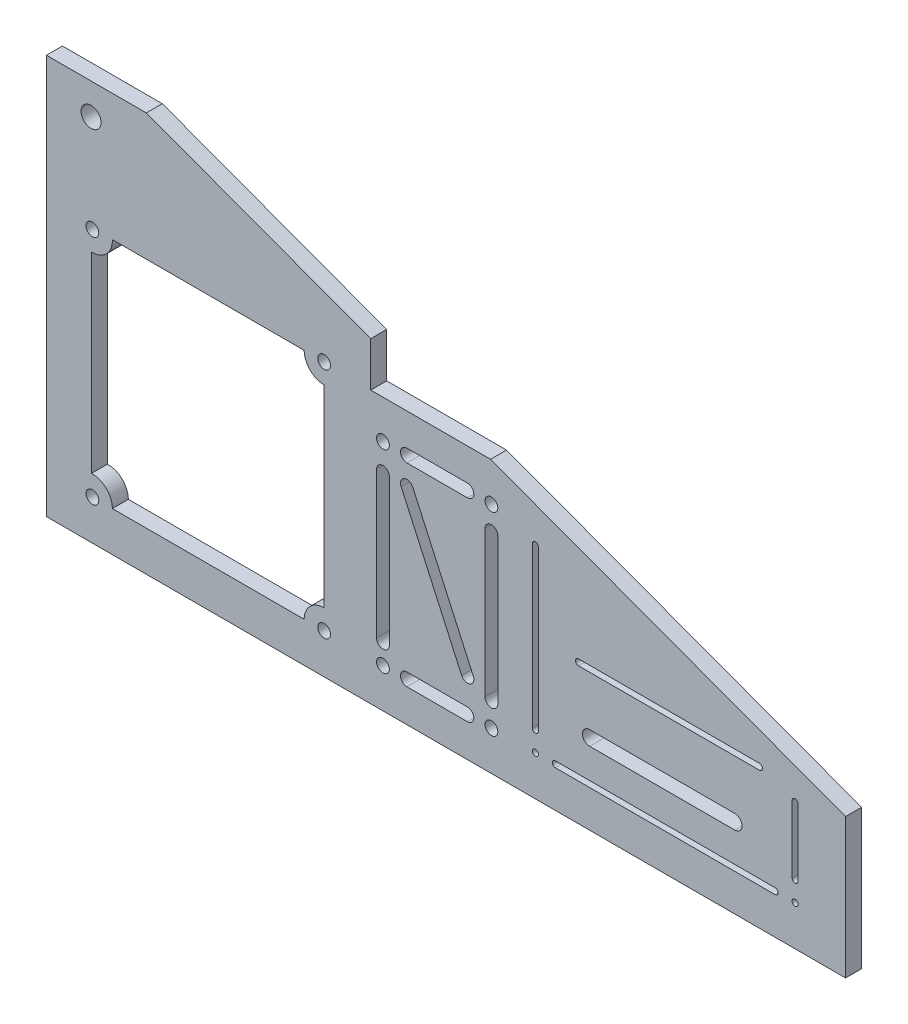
SolidWorks part; units mm, degrees
ref_plane "Front Plane" through (0, 0, 0) normal (0, 0, 1) x (1, 0, 0)
ref_plane "Top Plane" through (0, 0, 0) normal (0, 1, 0) x (1, 0, 0)
ref_plane "Right Plane" through (0, 0, 0) normal (1, 0, 0) x (0, 0, -1)
sketch "Sketch2" plane through (0, 0, 0) normal (0, 0, 1) x (1, 0, 0)
  line L0 (0, 0) -> (0, 73.4827)
  line L1 (0, 73.4827) -> (0, 100)
  line L2 (0, 100) -> (25, 100)
  line L3 (25, 100) -> (81.1538, 79.1429)
  line L4 (200, 35) -> (200, 0)
  line L5 (200, 0) -> (0, 0)
  line L6 (11.2434, 14.9934) -> (11.2434, 63.0066)
  line L7 (16.4916, 68.29) -> (64.5, 68.29)
  line L8 (16.5, 10) -> (64.5, 10)
  line L10 (127.3603, 10) -> (182.3603, 10) construction
  line L11 (127.3603, 10.75) -> (182.3603, 10.75)
  line L12 (127.3603, 9.25) -> (182.3603, 9.25)
  line L13 (122.3603, 15) -> (122.3603, 55) construction
  line L14 (121.6103, 15) -> (121.6103, 55)
  line L15 (123.1103, 15) -> (123.1103, 55)
  line L16 (187.3603, 15) -> (187.3603, 31.7786) construction
  line L17 (186.6103, 15) -> (186.6103, 31.7786)
  line L18 (188.1103, 15) -> (188.1103, 31.7786)
  line L19 (69.5, 15) -> (69.5, 63.29)
  line L22 (90.2154, 9.8312) -> (105.3658, 9.8312) construction
  line L25 (135.9383, 20) -> (172.28, 20) construction
  line L26 (135.9383, 21.8) -> (172.28, 21.8)
  line L27 (135.9383, 18.2) -> (172.28, 18.2)
  line L28 (111.1538, 68) -> (81.1538, 68)
  line L29 (81.1538, 68) -> (81.1538, 79.1429)
  line L30 (111.1538, 68) -> (200, 35)
  line L31 (90.2154, 11.4312) -> (105.3658, 11.4312)
  line L32 (90.2154, 8.2312) -> (105.3658, 8.2312)
  line L33 (84.2154, 15) -> (84.2154, 51.5767) construction
  line L34 (82.6154, 15) -> (82.6154, 51.5767)
  line L35 (85.8154, 15) -> (85.8154, 51.5767)
  line L36 (111.3658, 15.8312) -> (111.3658, 52.3538) construction
  line L37 (109.7658, 15.8312) -> (109.7658, 52.3538)
  line L38 (112.9658, 15.8312) -> (112.9658, 52.3538)
  line L39 (105.3658, 58.3538) -> (90.2154, 58.3538) construction
  line L40 (105.3658, 56.7538) -> (90.2154, 56.7538)
  line L41 (105.3658, 59.9538) -> (90.2154, 59.9538)
  line L42 (90.2154, 51.5767) -> (105.3658, 18.2) construction
  line L43 (91.6723, 52.238) -> (106.8227, 18.8613)
  line L44 (88.7584, 50.9153) -> (103.9089, 17.5387)
  line L45 (133.1492, 35) -> (178.4456, 35) construction
  line L46 (133.1492, 35.75) -> (178.4456, 35.75)
  line L47 (133.1492, 34.25) -> (178.4456, 34.25)
  arc A4 (16.4916, 68.29) -> (11.2434, 63.0066) centre (11.5, 68) cw
  arc A5 (16.5, 10) -> (11.2434, 14.9934) centre (11.5, 10) ccw
  arc A6 (64.5, 10) -> (69.5, 15) centre (69.5, 10) cw
  arc A7 (69.5, 63.29) -> (64.5, 68.29) centre (69.5, 68.29) cw
  circle A8 centre (11.5, 68) radius 1.6
  circle A9 centre (69.5, 68.29) radius 1.6
  circle A10 centre (69.5, 10) radius 1.6
  circle A11 centre (11.5, 10) radius 1.6
  circle A12 centre (122.3603, 10) radius 0.75
  arc A13 (127.3603, 10.75) -> (127.3603, 9.25) centre (127.3603, 10) ccw
  arc A14 (182.3603, 9.25) -> (182.3603, 10.75) centre (182.3603, 10) ccw
  circle A15 centre (187.3603, 10) radius 0.75
  arc A16 (121.6103, 15) -> (123.1103, 15) centre (122.3603, 15) ccw
  arc A17 (123.1103, 55) -> (121.6103, 55) centre (122.3603, 55) ccw
  arc A18 (186.6103, 15) -> (188.1103, 15) centre (187.3603, 15) ccw
  arc A19 (188.1103, 31.7786) -> (186.6103, 31.7786) centre (187.3603, 31.7786) ccw
  arc A25 (135.9383, 21.8) -> (135.9383, 18.2) centre (135.9383, 20) ccw
  arc A26 (172.28, 18.2) -> (172.28, 21.8) centre (172.28, 20) ccw
  circle A27 centre (11.1667, 92.2208) radius 2.5
  circle A28 centre (111.3658, 9.8312) radius 1.6
  circle A29 centre (84.2154, 9.8312) radius 1.6
  arc A30 (90.2154, 11.4312) -> (90.2154, 8.2312) centre (90.2154, 9.8312) ccw
  arc A31 (105.3658, 8.2312) -> (105.3658, 11.4312) centre (105.3658, 9.8312) ccw
  arc A32 (82.6154, 15) -> (85.8154, 15) centre (84.2154, 15) ccw
  arc A33 (85.8154, 51.5767) -> (82.6154, 51.5767) centre (84.2154, 51.5767) ccw
  arc A34 (109.7658, 15.8312) -> (112.9658, 15.8312) centre (111.3658, 15.8312) ccw
  arc A35 (112.9658, 52.3538) -> (109.7658, 52.3538) centre (111.3658, 52.3538) ccw
  arc A36 (105.3658, 56.7538) -> (105.3658, 59.9538) centre (105.3658, 58.3538) ccw
  arc A37 (90.2154, 59.9538) -> (90.2154, 56.7538) centre (90.2154, 58.3538) ccw
  circle A38 centre (84.2154, 58.3538) radius 1.6
  circle A39 centre (111.3658, 58.3538) radius 1.6
  arc A40 (91.6723, 52.238) -> (88.7584, 50.9153) centre (90.2154, 51.5767) ccw
  arc A41 (103.9089, 17.5387) -> (106.8227, 18.8613) centre (105.3658, 18.2) ccw
  arc A42 (133.1492, 35.75) -> (133.1492, 34.25) centre (133.1492, 35) ccw
  arc A43 (178.4456, 34.25) -> (178.4456, 35.75) centre (178.4456, 35) ccw
  point P27 (154.8603, 10)
  point P36 (122.3603, 35)
  point P41 (187.3603, 23.3893)
  point P52 (97.7906, 9.8312)
  point P59 (84.2154, 33.2883)
  point P66 (154.1091, 20)
  point P78 (111.3658, 34.0925)
  point P85 (97.7906, 58.3538)
  point P98 (97.7906, 34.8883)
  point P105 (155.7974, 35)
  dimension "D13" = 58
  dimension "D14" = 5
  dimension "D12" = 5
  dimension "D15" = 3.2
  dimension "D16" = 5
  dimension "D17" = 3.2
  dimension "D18" = 5
  dimension "D19" = 3.2
  dimension "D20" = 1.5
  dimension "D23" = 1.5
  dimension "D29" = 0
  dimension "D37" = 5
  dimension "D11" = 3.2
  dimension "D33" = 3.2
  dimension "D45" = 3.2
  dimension "D47" = 3.2
  dimension "D49" = 3.2
  dimension "D60" = 1.6
  dimension "D61" = 0.75
  dimension "D1" = 200
  dimension "D5" = 58
  dimension "D6" = 10
  dimension "D7" = 0
  dimension "D8" = 0
  dimension "D9" = 0
  dimension "D10" = 11.5
  dimension "D21" = 1.5
  dimension "D22" = 1.5
  dimension "D24" = 1.5
  dimension "D25" = 5
  dimension "D26" = 5
  dimension "D27" = 0
  dimension "D28" = 3.6
  dimension "D30" = 58
  dimension "D31" = 0
  dimension "D32" = 3.2
  dimension "D34" = 100
  dimension "D35" = 25
  dimension "D36" = 35
  dimension "D38" = 5
  dimension "D39" = 10
  dimension "D40" = 5
  dimension "D41" = 20
  dimension "D42" = 30
  dimension "D43" = 68
  dimension "D44" = 3.2
  dimension "D46" = 3.2
  dimension "D48" = 3.2
  dimension "D50" = 0
  dimension "D51" = 6
  dimension "D52" = 0
  dimension "D53" = 0
  dimension "D54" = 6
  dimension "D55" = 0
  dimension "D56" = 6
  dimension "D57" = 6
  dimension "D58" = 6
  dimension "D59" = 6
extrude "Boss-Extrude1" add sketch "Sketch2" along normal blind 4
ref_plane "Plane1" through (0, 100, 0) normal (0, 1, 0) x (1, 0, 0)
